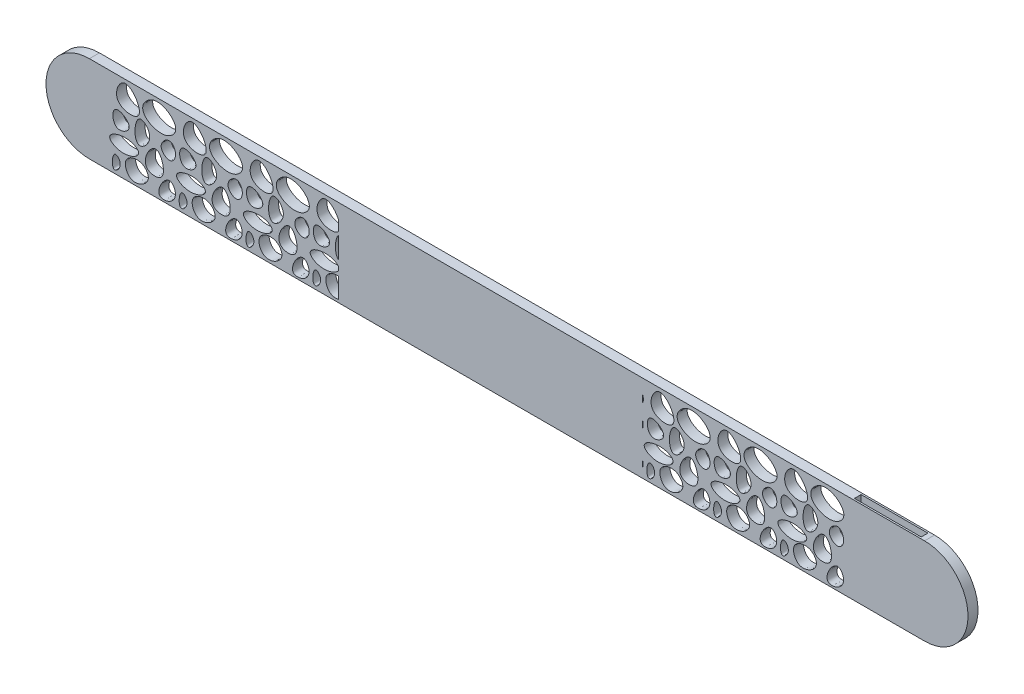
SolidWorks part; units mm, degrees
ref_plane "Alzado" through (0, 0, 0) normal (0, 0, 1) x (1, 0, 0)
ref_plane "Planta" through (0, 0, 0) normal (0, 1, 0) x (1, 0, 0)
ref_plane "Vista lateral" through (0, 0, 0) normal (1, 0, 0) x (0, 0, -1)
sketch "Croquis1" plane through (0, 0, 0) normal (0, 0, 1) x (1, 0, 0)
  line L1 (-120, 13) -> (130, 13)
  line L3 (-120, -13) -> (130, -13)
  arc A0 (130, -13) -> (130, 13) centre (130, 0) ccw
  arc A1 (-120, 13) -> (-120, -13) centre (-120, 0) ccw
  dimension "D1" = 250
  dimension "D2" = 26
  dimension "D3" = 13
  dimension "D4" = 130
extrude "Saliente-Extruir1" add sketch "Croquis1" along normal blind 3
sketch "Croquis7" plane through (0, 13, 0) normal (0, 1, 0) x (1, 0, 0)
  line L0 (130, 0) -> (-120, 0) construction
  line L1 (108.5, -0.5) -> (128.5, -0.5)
  line L2 (108.5, -0.5) -> (108.5, -2.5)
  line L3 (108.5, -2.5) -> (128.5, -2.5)
  line L4 (128.5, -0.5) -> (128.5, -2.5)
  dimension "D1" = 20
  dimension "D2" = 2
  dimension "D3" = 0.5
  dimension "D4" = 1.5
extrude "Cortar-Extruir1" cut sketch "Croquis7" against normal blind 23 and the other way through all
sketch "Croquis9" plane through (0, 0, 0) normal (0, 0, -1) x (-1, 0, 0)
  line L0 (-106.7091, 13) -> (-106.3785, -13) construction
  line L1 (-130, 13) -> (120, 13) construction
  line L2 (120, -13) -> (-130, -13) construction
  line L3 (-25.5, 13) -> (-25.5, -13) construction
  line L4 (25.5, 13) -> (25.5, -13) construction
  spline S0 degree 3 poles (-93.3912, 7.056) (-100.0786, 14.2752) (-108.0642, 8.2517) (-101.9358, 2.7886) (-93.3912, 7.056) (-100.0786, 14.2752) (-108.0642, 8.2517) knots -0.688776 -0.523757 -0.211948 0 0.311224 0.476243 0.788052 1 1.311224 1.476243 1.788052 only from (-99.5922, 11.9229) to (-99.5922, 11.9229)
  spline S1 degree 3 poles (-85.9792, 4.8516) (-90.5397, 15.9234) (-98.4431, 3.5532) (-85.9792, 4.8516) (-90.5397, 15.9234) (-98.4431, 3.5532) knots -1 -0.615056 -0.296776 0 0.384944 0.703224 1 1.384944 1.703224 2 only from (-90.5695, 11.9186) to (-90.5695, 11.9186)
  spline S2 degree 3 poles (-92.8631, -5.3459) (-93.5465, 8.0215) (-99.9978, 1.5338) (-92.8631, -5.3459) (-93.5465, 8.0215) (-99.9978, 1.5338) knots -1 -0.733128 -0.426255 0 0.266872 0.573745 1 1.266872 1.573745 2 only from (-95.1674, 4.9473) to (-95.1674, 4.9473)
  spline S3 degree 3 poles (-94.3645, -7.2568) (-99.4628, 1.9883) (-102.4759, -3.5424) (-102.0366, -8.2256) (-94.3645, -7.2568) (-99.4628, 1.9883) (-102.4759, -3.5424) knots -0.807322 -0.590215 -0.365844 0 0.192678 0.409785 0.634156 1 1.192678 1.409785 1.634156 only from (-99.9609, -0.5054) to (-99.9609, -0.5054)
  spline S4 degree 3 poles (-99.9377, 0.9299) (-104.4145, 5.2302) (-106.4699, 0.7447) (-104.0788, -2.3597) (-99.9377, 0.9299) (-104.4145, 5.2302) (-106.4699, 0.7447) knots -0.732409 -0.553556 -0.284091 0 0.267591 0.446444 0.715909 1 1.267591 1.446444 1.715909 only from (-104.1185, 3.6522) to (-104.1185, 3.6522)
  spline S5 degree 3 poles (-89.4862, -6.8942) (-95.7751, -5.1482) (-99.116, -10.2756) (-92.144, -14.0481) (-89.4862, -6.8942) (-95.7751, -5.1482) (-99.116, -10.2756) knots -0.814733 -0.509077 -0.271879 0 0.185267 0.490923 0.728121 1 1.185267 1.490923 1.728121 only from (-95.8032, -6.4239) to (-95.8032, -6.4239)
  spline S6 degree 3 poles (-98.7079, -12.9336) (-103.3056, -4.6297) (-106.3464, -8.9529) (-104.936, -12.3177) (-98.7079, -12.9336) (-103.3056, -4.6297) (-106.3464, -8.9529) knots -0.848525 -0.604053 -0.402524 0 0.151475 0.395947 0.597476 1 1.151475 1.395947 1.597476 only from (-104.1674, -6.6684) to (-104.1674, -6.6684)
  spline S7 degree 3 poles (-83.5552, -3.8502) (-90.9721, -1.1542) (-96.5501, -4.3001) (-90.2697, -7.6235) (-83.5552, -3.8502) (-90.9721, -1.1542) (-96.5501, -4.3001) knots -0.828964 -0.55664 -0.320938 0 0.171036 0.44336 0.679062 1 1.171036 1.44336 1.679062 only from (-91.894, -2.2362) to (-91.894, -2.2362)
  spline S8 degree 3 poles (-86.3596, -14.089) (-86.8801, -6.0725) (-90.2311, -9.9319) (-86.3596, -14.089) (-86.8801, -6.0725) (-90.2311, -9.9319) knots -1 -0.747213 -0.44036 0 0.252787 0.55964 1 1.252787 1.55964 2 only from (-87.7696, -7.8913) to (-87.7696, -7.8913)
  spline S9 degree 3 poles (-87.0508, -2.7255) (-94.488, 1.1864) (-86.3164, 6.264) (-87.0508, -2.7255) (-94.488, 1.1864) (-86.3164, 6.264) knots -1 -0.637475 -0.302461 0 0.362525 0.697539 1 1.362525 1.697539 2 only from (-91.894, 1.1118) to (-91.894, 1.1118)
  spline S10 degree 3 poles (-73.3912, 7.056) (-80.0786, 14.2752) (-88.0642, 8.2517) (-81.9358, 2.7886) (-73.3912, 7.056) (-80.0786, 14.2752) (-88.0642, 8.2517) knots -0.688776 -0.523757 -0.211948 0 0.311224 0.476243 0.788052 1 1.311224 1.476243 1.788052 only from (-79.5922, 11.9229) to (-79.5922, 11.9229)
  spline S11 degree 3 poles (-65.9792, 4.8516) (-70.5397, 15.9234) (-78.4431, 3.5532) (-65.9792, 4.8516) (-70.5397, 15.9234) (-78.4431, 3.5532) knots -1 -0.615056 -0.296776 0 0.384944 0.703224 1 1.384944 1.703224 2 only from (-70.5695, 11.9186) to (-70.5695, 11.9186)
  spline S12 degree 3 poles (-72.8631, -5.3459) (-73.5465, 8.0215) (-79.9978, 1.5338) (-72.8631, -5.3459) (-73.5465, 8.0215) (-79.9978, 1.5338) knots -1 -0.733128 -0.426255 0 0.266872 0.573745 1 1.266872 1.573745 2 only from (-75.1674, 4.9473) to (-75.1674, 4.9473)
  spline S13 degree 3 poles (-74.3645, -7.2568) (-79.4628, 1.9883) (-82.4759, -3.5424) (-82.0366, -8.2256) (-74.3645, -7.2568) (-79.4628, 1.9883) (-82.4759, -3.5424) knots -0.807322 -0.590215 -0.365844 0 0.192678 0.409785 0.634156 1 1.192678 1.409785 1.634156 only from (-79.9609, -0.5054) to (-79.9609, -0.5054)
  spline S14 degree 3 poles (-79.9377, 0.9299) (-84.4145, 5.2302) (-86.4699, 0.7447) (-84.0788, -2.3597) (-79.9377, 0.9299) (-84.4145, 5.2302) (-86.4699, 0.7447) knots -0.732409 -0.553556 -0.284091 0 0.267591 0.446444 0.715909 1 1.267591 1.446444 1.715909 only from (-84.1185, 3.6522) to (-84.1185, 3.6522)
  spline S15 degree 3 poles (-69.4862, -6.8942) (-75.7751, -5.1482) (-79.116, -10.2756) (-72.144, -14.0481) (-69.4862, -6.8942) (-75.7751, -5.1482) (-79.116, -10.2756) knots -0.814733 -0.509077 -0.271879 0 0.185267 0.490923 0.728121 1 1.185267 1.490923 1.728121 only from (-75.8032, -6.4239) to (-75.8032, -6.4239)
  spline S16 degree 3 poles (-78.7079, -12.9336) (-83.3056, -4.6297) (-86.3464, -8.9529) (-84.936, -12.3177) (-78.7079, -12.9336) (-83.3056, -4.6297) (-86.3464, -8.9529) knots -0.848525 -0.604053 -0.402524 0 0.151475 0.395947 0.597476 1 1.151475 1.395947 1.597476 only from (-84.1674, -6.6684) to (-84.1674, -6.6684)
  spline S17 degree 3 poles (-63.5552, -3.8502) (-70.9721, -1.1542) (-76.5501, -4.3001) (-70.2697, -7.6235) (-63.5552, -3.8502) (-70.9721, -1.1542) (-76.5501, -4.3001) knots -0.828964 -0.55664 -0.320938 0 0.171036 0.44336 0.679062 1 1.171036 1.44336 1.679062 only from (-71.894, -2.2362) to (-71.894, -2.2362)
  spline S18 degree 3 poles (-66.3596, -14.089) (-66.8801, -6.0725) (-70.2311, -9.9319) (-66.3596, -14.089) (-66.8801, -6.0725) (-70.2311, -9.9319) knots -1 -0.747213 -0.44036 0 0.252787 0.55964 1 1.252787 1.55964 2 only from (-67.7696, -7.8913) to (-67.7696, -7.8913)
  spline S19 degree 3 poles (-67.0508, -2.7255) (-74.488, 1.1864) (-66.3164, 6.264) (-67.0508, -2.7255) (-74.488, 1.1864) (-66.3164, 6.264) knots -1 -0.637475 -0.302461 0 0.362525 0.697539 1 1.362525 1.697539 2 only from (-71.894, 1.1118) to (-71.894, 1.1118)
  spline S20 degree 3 poles (-53.3912, 7.056) (-60.0786, 14.2752) (-68.0642, 8.2517) (-61.9358, 2.7886) (-53.3912, 7.056) (-60.0786, 14.2752) (-68.0642, 8.2517) knots -0.688776 -0.523757 -0.211948 0 0.311224 0.476243 0.788052 1 1.311224 1.476243 1.788052 only from (-59.5922, 11.9229) to (-59.5922, 11.9229)
  spline S21 degree 3 poles (-45.9792, 4.8516) (-50.5397, 15.9234) (-58.4431, 3.5532) (-45.9792, 4.8516) (-50.5397, 15.9234) (-58.4431, 3.5532) knots -1 -0.615056 -0.296776 0 0.384944 0.703224 1 1.384944 1.703224 2 only from (-50.5695, 11.9186) to (-50.5695, 11.9186)
  spline S22 degree 3 poles (-52.8631, -5.3459) (-53.5465, 8.0215) (-59.9978, 1.5338) (-52.8631, -5.3459) (-53.5465, 8.0215) (-59.9978, 1.5338) knots -1 -0.733128 -0.426255 0 0.266872 0.573745 1 1.266872 1.573745 2 only from (-55.1674, 4.9473) to (-55.1674, 4.9473)
  spline S23 degree 3 poles (-54.3645, -7.2568) (-59.4628, 1.9883) (-62.4759, -3.5424) (-62.0366, -8.2256) (-54.3645, -7.2568) (-59.4628, 1.9883) (-62.4759, -3.5424) knots -0.807322 -0.590215 -0.365844 0 0.192678 0.409785 0.634156 1 1.192678 1.409785 1.634156 only from (-59.9609, -0.5054) to (-59.9609, -0.5054)
  spline S24 degree 3 poles (-59.9377, 0.9299) (-64.4145, 5.2302) (-66.4699, 0.7447) (-64.0788, -2.3597) (-59.9377, 0.9299) (-64.4145, 5.2302) (-66.4699, 0.7447) knots -0.732409 -0.553556 -0.284091 0 0.267591 0.446444 0.715909 1 1.267591 1.446444 1.715909 only from (-64.1185, 3.6522) to (-64.1185, 3.6522)
  spline S25 degree 3 poles (-49.4862, -6.8942) (-55.7751, -5.1482) (-59.116, -10.2756) (-52.144, -14.0481) (-49.4862, -6.8942) (-55.7751, -5.1482) (-59.116, -10.2756) knots -0.814733 -0.509077 -0.271879 0 0.185267 0.490923 0.728121 1 1.185267 1.490923 1.728121 only from (-55.8032, -6.4239) to (-55.8032, -6.4239)
  spline S26 degree 3 poles (-58.7079, -12.9336) (-63.3056, -4.6297) (-66.3464, -8.9529) (-64.936, -12.3177) (-58.7079, -12.9336) (-63.3056, -4.6297) (-66.3464, -8.9529) knots -0.848525 -0.604053 -0.402524 0 0.151475 0.395947 0.597476 1 1.151475 1.395947 1.597476 only from (-64.1674, -6.6684) to (-64.1674, -6.6684)
  spline S27 degree 3 poles (-43.5552, -3.8502) (-50.9721, -1.1542) (-56.5501, -4.3001) (-50.2697, -7.6235) (-43.5552, -3.8502) (-50.9721, -1.1542) (-56.5501, -4.3001) knots -0.828964 -0.55664 -0.320938 0 0.171036 0.44336 0.679062 1 1.171036 1.44336 1.679062 only from (-51.894, -2.2362) to (-51.894, -2.2362)
  spline S28 degree 3 poles (-46.3596, -14.089) (-46.8801, -6.0725) (-50.2311, -9.9319) (-46.3596, -14.089) (-46.8801, -6.0725) (-50.2311, -9.9319) knots -1 -0.747213 -0.44036 0 0.252787 0.55964 1 1.252787 1.55964 2 only from (-47.7696, -7.8913) to (-47.7696, -7.8913)
  spline S29 degree 3 poles (-47.0508, -2.7255) (-54.488, 1.1864) (-46.3164, 6.264) (-47.0508, -2.7255) (-54.488, 1.1864) (-46.3164, 6.264) knots -1 -0.637475 -0.302461 0 0.362525 0.697539 1 1.362525 1.697539 2 only from (-51.894, 1.1118) to (-51.894, 1.1118)
  spline S30 degree 3 poles (-33.3912, 7.056) (-40.0786, 14.2752) (-48.0642, 8.2517) (-41.9358, 2.7886) (-33.3912, 7.056) (-40.0786, 14.2752) (-48.0642, 8.2517) knots -0.688776 -0.523757 -0.211948 0 0.311224 0.476243 0.788052 1 1.311224 1.476243 1.788052 only from (-39.5922, 11.9229) to (-39.5922, 11.9229)
  spline S31 degree 3 poles (-25.9792, 4.8516) (-30.5397, 15.9234) (-38.4431, 3.5532) (-25.9792, 4.8516) (-30.5397, 15.9234) (-38.4431, 3.5532) knots -1 -0.615056 -0.296776 0 0.384944 0.703224 1 1.384944 1.703224 2 only from (-30.5695, 11.9186) to (-30.5695, 11.9186)
  spline S32 degree 3 poles (-32.8631, -5.3459) (-33.5465, 8.0215) (-39.9978, 1.5338) (-32.8631, -5.3459) (-33.5465, 8.0215) (-39.9978, 1.5338) knots -1 -0.733128 -0.426255 0 0.266872 0.573745 1 1.266872 1.573745 2 only from (-35.1674, 4.9473) to (-35.1674, 4.9473)
  spline S33 degree 3 poles (-34.3645, -7.2568) (-39.4628, 1.9883) (-42.4759, -3.5424) (-42.0366, -8.2256) (-34.3645, -7.2568) (-39.4628, 1.9883) (-42.4759, -3.5424) knots -0.807322 -0.590215 -0.365844 0 0.192678 0.409785 0.634156 1 1.192678 1.409785 1.634156 only from (-39.9609, -0.5054) to (-39.9609, -0.5054)
  spline S34 degree 3 poles (-39.9377, 0.9299) (-44.4145, 5.2302) (-46.4699, 0.7447) (-44.0788, -2.3597) (-39.9377, 0.9299) (-44.4145, 5.2302) (-46.4699, 0.7447) knots -0.732409 -0.553556 -0.284091 0 0.267591 0.446444 0.715909 1 1.267591 1.446444 1.715909 only from (-44.1185, 3.6522) to (-44.1185, 3.6522)
  spline S35 degree 3 poles (-29.4862, -6.8942) (-35.7751, -5.1482) (-39.116, -10.2756) (-32.144, -14.0481) (-29.4862, -6.8942) (-35.7751, -5.1482) (-39.116, -10.2756) knots -0.814733 -0.509077 -0.271879 0 0.185267 0.490923 0.728121 1 1.185267 1.490923 1.728121 only from (-35.8032, -6.4239) to (-35.8032, -6.4239)
  spline S36 degree 3 poles (-38.7079, -12.9336) (-43.3056, -4.6297) (-46.3464, -8.9529) (-44.936, -12.3177) (-38.7079, -12.9336) (-43.3056, -4.6297) (-46.3464, -8.9529) knots -0.848525 -0.604053 -0.402524 0 0.151475 0.395947 0.597476 1 1.151475 1.395947 1.597476 only from (-44.1674, -6.6684) to (-44.1674, -6.6684)
  spline S37 degree 3 poles (-23.5552, -3.8502) (-30.9721, -1.1542) (-36.5501, -4.3001) (-30.2697, -7.6235) (-23.5552, -3.8502) (-30.9721, -1.1542) (-36.5501, -4.3001) knots -0.828964 -0.55664 -0.320938 0 0.171036 0.44336 0.679062 1 1.171036 1.44336 1.679062 only from (-31.894, -2.2362) to (-31.894, -2.2362)
  spline S38 degree 3 poles (-26.7789, -13.9675) (-23.3935, -5.8398) (-30.8462, -9.028) (-26.7789, -13.9675) (-23.3935, -5.8398) (-30.8462, -9.028) knots -1 -0.640159 -0.392048 0 0.359841 0.607952 1 1.359841 1.607952 2 only from (-25.5, -7.8913) to (-25.5, -7.8913)
  spline S39 degree 3 poles (-27.0508, -2.7255) (-34.488, 1.1864) (-26.3164, 6.264) (-27.0508, -2.7255) (-34.488, 1.1864) (-26.3164, 6.264) knots -1 -0.637475 -0.302461 0 0.362525 0.697539 1 1.362525 1.697539 2 only from (-31.894, 1.1118) to (-31.894, 1.1118)
  spline S40 degree 3 poles (-13.3912, 7.056) (-20.0786, 14.2752) (-28.0642, 8.2517) (-21.9358, 2.7886) (-13.3912, 7.056) (-20.0786, 14.2752) (-28.0642, 8.2517) knots -0.688776 -0.523757 -0.211948 0 0.311224 0.476243 0.788052 1 1.311224 1.476243 1.788052 only from (-19.5922, 11.9229) to (-19.5922, 11.9229)
  spline S41 degree 3 poles (-5.9792, 4.8516) (-10.5397, 15.9234) (-18.4431, 3.5532) (-5.9792, 4.8516) (-10.5397, 15.9234) (-18.4431, 3.5532) knots -1 -0.615056 -0.296776 0 0.384944 0.703224 1 1.384944 1.703224 2 only from (-10.5695, 11.9186) to (-10.5695, 11.9186)
  spline S42 degree 3 poles (-12.8631, -5.3459) (-13.5465, 8.0215) (-19.9978, 1.5338) (-12.8631, -5.3459) (-13.5465, 8.0215) (-19.9978, 1.5338) knots -1 -0.733128 -0.426255 0 0.266872 0.573745 1 1.266872 1.573745 2 only from (-15.1674, 4.9473) to (-15.1674, 4.9473)
  spline S43 degree 3 poles (-14.3645, -7.2568) (-19.4628, 1.9883) (-22.4759, -3.5424) (-22.0366, -8.2256) (-14.3645, -7.2568) (-19.4628, 1.9883) (-22.4759, -3.5424) knots -0.807322 -0.590215 -0.365844 0 0.192678 0.409785 0.634156 1 1.192678 1.409785 1.634156 only from (-19.9609, -0.5054) to (-19.9609, -0.5054)
  spline S44 degree 3 poles (-19.9377, 0.9299) (-24.4145, 5.2302) (-26.4699, 0.7447) (-24.0788, -2.3597) (-19.9377, 0.9299) (-24.4145, 5.2302) (-26.4699, 0.7447) knots -0.732409 -0.553556 -0.284091 0 0.267591 0.446444 0.715909 1 1.267591 1.446444 1.715909 only from (-24.1185, 3.6522) to (-24.1185, 3.6522)
  spline S45 degree 3 poles (-9.4862, -6.8942) (-15.7751, -5.1482) (-19.116, -10.2756) (-12.144, -14.0481) (-9.4862, -6.8942) (-15.7751, -5.1482) (-19.116, -10.2756) knots -0.814733 -0.509077 -0.271879 0 0.185267 0.490923 0.728121 1 1.185267 1.490923 1.728121 only from (-15.8032, -6.4239) to (-15.8032, -6.4239)
  spline S46 degree 3 poles (-18.7079, -12.9336) (-23.3056, -4.6297) (-26.3464, -8.9529) (-24.936, -12.3177) (-18.7079, -12.9336) (-23.3056, -4.6297) (-26.3464, -8.9529) knots -0.848525 -0.604053 -0.402524 0 0.151475 0.395947 0.597476 1 1.151475 1.395947 1.597476 only from (-24.1674, -6.6684) to (-24.1674, -6.6684)
  spline S47 degree 3 poles (-3.5552, -3.8502) (-10.9721, -1.1542) (-16.5501, -4.3001) (-10.2697, -7.6235) (-3.5552, -3.8502) (-10.9721, -1.1542) (-16.5501, -4.3001) knots -0.828964 -0.55664 -0.320938 0 0.171036 0.44336 0.679062 1 1.171036 1.44336 1.679062 only from (-11.894, -2.2362) to (-11.894, -2.2362)
  spline S48 degree 3 poles (-6.3596, -14.089) (-6.8801, -6.0725) (-10.2311, -9.9319) (-6.3596, -14.089) (-6.8801, -6.0725) (-10.2311, -9.9319) knots -1 -0.747213 -0.44036 0 0.252787 0.55964 1 1.252787 1.55964 2 only from (-7.7696, -7.8913) to (-7.7696, -7.8913)
  spline S49 degree 3 poles (-7.0508, -2.7255) (-14.488, 1.1864) (-6.3164, 6.264) (-7.0508, -2.7255) (-14.488, 1.1864) (-6.3164, 6.264) knots -1 -0.637475 -0.302461 0 0.362525 0.697539 1 1.362525 1.697539 2 only from (-11.894, 1.1118) to (-11.894, 1.1118)
  spline S50 degree 3 poles (6.6088, 7.056) (-0.0786, 14.2752) (-8.0642, 8.2517) (-1.9358, 2.7886) (6.6088, 7.056) (-0.0786, 14.2752) (-8.0642, 8.2517) knots -0.688776 -0.523757 -0.211948 0 0.311224 0.476243 0.788052 1 1.311224 1.476243 1.788052 only from (0.4078, 11.9229) to (0.4078, 11.9229)
  spline S51 degree 3 poles (14.0208, 4.8516) (9.4603, 15.9234) (1.5569, 3.5532) (14.0208, 4.8516) (9.4603, 15.9234) (1.5569, 3.5532) knots -1 -0.615056 -0.296776 0 0.384944 0.703224 1 1.384944 1.703224 2 only from (9.4305, 11.9186) to (9.4305, 11.9186)
  spline S52 degree 3 poles (7.1369, -5.3459) (6.4535, 8.0215) (0.0022, 1.5338) (7.1369, -5.3459) (6.4535, 8.0215) (0.0022, 1.5338) knots -1 -0.733128 -0.426255 0 0.266872 0.573745 1 1.266872 1.573745 2 only from (4.8326, 4.9473) to (4.8326, 4.9473)
  spline S53 degree 3 poles (5.6355, -7.2568) (0.5372, 1.9883) (-2.4759, -3.5424) (-2.0366, -8.2256) (5.6355, -7.2568) (0.5372, 1.9883) (-2.4759, -3.5424) knots -0.807322 -0.590215 -0.365844 0 0.192678 0.409785 0.634156 1 1.192678 1.409785 1.634156 only from (0.0391, -0.5054) to (0.0391, -0.5054)
  spline S54 degree 3 poles (0.0623, 0.9299) (-4.4145, 5.2302) (-6.4699, 0.7447) (-4.0788, -2.3597) (0.0623, 0.9299) (-4.4145, 5.2302) (-6.4699, 0.7447) knots -0.732409 -0.553556 -0.284091 0 0.267591 0.446444 0.715909 1 1.267591 1.446444 1.715909 only from (-4.1185, 3.6522) to (-4.1185, 3.6522)
  spline S55 degree 3 poles (10.5138, -6.8942) (4.2249, -5.1482) (0.884, -10.2756) (7.856, -14.0481) (10.5138, -6.8942) (4.2249, -5.1482) (0.884, -10.2756) knots -0.814733 -0.509077 -0.271879 0 0.185267 0.490923 0.728121 1 1.185267 1.490923 1.728121 only from (4.1968, -6.4239) to (4.1968, -6.4239)
  spline S56 degree 3 poles (1.2921, -12.9336) (-3.3056, -4.6297) (-6.3464, -8.9529) (-4.936, -12.3177) (1.2921, -12.9336) (-3.3056, -4.6297) (-6.3464, -8.9529) knots -0.848525 -0.604053 -0.402524 0 0.151475 0.395947 0.597476 1 1.151475 1.395947 1.597476 only from (-4.1674, -6.6684) to (-4.1674, -6.6684)
  spline S57 degree 3 poles (16.4448, -3.8502) (9.0279, -1.1542) (3.4499, -4.3001) (9.7303, -7.6235) (16.4448, -3.8502) (9.0279, -1.1542) (3.4499, -4.3001) knots -0.828964 -0.55664 -0.320938 0 0.171036 0.44336 0.679062 1 1.171036 1.44336 1.679062 only from (8.106, -2.2362) to (8.106, -2.2362)
  spline S58 degree 3 poles (13.6404, -14.089) (13.1199, -6.0725) (9.7689, -9.9319) (13.6404, -14.089) (13.1199, -6.0725) (9.7689, -9.9319) knots -1 -0.747213 -0.44036 0 0.252787 0.55964 1 1.252787 1.55964 2 only from (12.2304, -7.8913) to (12.2304, -7.8913)
  spline S59 degree 3 poles (12.9492, -2.7255) (5.512, 1.1864) (13.6836, 6.264) (12.9492, -2.7255) (5.512, 1.1864) (13.6836, 6.264) knots -1 -0.637475 -0.302461 0 0.362525 0.697539 1 1.362525 1.697539 2 only from (8.106, 1.1118) to (8.106, 1.1118)
  spline S60 degree 3 poles (26.6088, 7.056) (19.9214, 14.2752) (11.9358, 8.2517) (18.0642, 2.7886) (26.6088, 7.056) (19.9214, 14.2752) (11.9358, 8.2517) knots -0.688776 -0.523757 -0.211948 0 0.311224 0.476243 0.788052 1 1.311224 1.476243 1.788052 only from (20.4078, 11.9229) to (20.4078, 11.9229)
  spline S61 degree 3 poles (34.0208, 4.8516) (29.4603, 15.9234) (21.5569, 3.5532) (34.0208, 4.8516) (29.4603, 15.9234) (21.5569, 3.5532) knots -1 -0.615056 -0.296776 0 0.384944 0.703224 1 1.384944 1.703224 2 only from (29.4305, 11.9186) to (29.4305, 11.9186)
  spline S62 degree 3 poles (27.1369, -5.3459) (26.4535, 8.0215) (20.0022, 1.5338) (27.1369, -5.3459) (26.4535, 8.0215) (20.0022, 1.5338) knots -1 -0.733128 -0.426255 0 0.266872 0.573745 1 1.266872 1.573745 2 only from (24.8326, 4.9473) to (24.8326, 4.9473)
  spline S63 degree 3 poles (25.6355, -7.2568) (20.5372, 1.9883) (17.5241, -3.5424) (17.9634, -8.2256) (25.6355, -7.2568) (20.5372, 1.9883) (17.5241, -3.5424) knots -0.807322 -0.590215 -0.365844 0 0.192678 0.409785 0.634156 1 1.192678 1.409785 1.634156 only from (20.0391, -0.5054) to (20.0391, -0.5054)
  spline S64 degree 3 poles (20.0623, 0.9299) (15.5855, 5.2302) (13.5301, 0.7447) (15.9212, -2.3597) (20.0623, 0.9299) (15.5855, 5.2302) (13.5301, 0.7447) knots -0.732409 -0.553556 -0.284091 0 0.267591 0.446444 0.715909 1 1.267591 1.446444 1.715909 only from (15.8815, 3.6522) to (15.8815, 3.6522)
  spline S65 degree 3 poles (30.5138, -6.8942) (24.2249, -5.1482) (20.884, -10.2756) (27.856, -14.0481) (30.5138, -6.8942) (24.2249, -5.1482) (20.884, -10.2756) knots -0.814733 -0.509077 -0.271879 0 0.185267 0.490923 0.728121 1 1.185267 1.490923 1.728121 only from (24.1968, -6.4239) to (24.1968, -6.4239)
  spline S66 degree 3 poles (21.2921, -12.9336) (16.6944, -4.6297) (13.6536, -8.9529) (15.064, -12.3177) (21.2921, -12.9336) (16.6944, -4.6297) (13.6536, -8.9529) knots -0.848525 -0.604053 -0.402524 0 0.151475 0.395947 0.597476 1 1.151475 1.395947 1.597476 only from (15.8326, -6.6684) to (15.8326, -6.6684)
  spline S67 degree 3 poles (36.4448, -3.8502) (29.0279, -1.1542) (23.4499, -4.3001) (29.7303, -7.6235) (36.4448, -3.8502) (29.0279, -1.1542) (23.4499, -4.3001) knots -0.828964 -0.55664 -0.320938 0 0.171036 0.44336 0.679062 1 1.171036 1.44336 1.679062 only from (28.106, -2.2362) to (28.106, -2.2362)
  spline S68 degree 3 poles (33.6404, -14.089) (33.1199, -6.0725) (29.7689, -9.9319) (33.6404, -14.089) (33.1199, -6.0725) (29.7689, -9.9319) knots -1 -0.747213 -0.44036 0 0.252787 0.55964 1 1.252787 1.55964 2 only from (32.2304, -7.8913) to (32.2304, -7.8913)
  spline S69 degree 3 poles (32.9492, -2.7255) (25.512, 1.1864) (33.6836, 6.264) (32.9492, -2.7255) (25.512, 1.1864) (33.6836, 6.264) knots -1 -0.637475 -0.302461 0 0.362525 0.697539 1 1.362525 1.697539 2 only from (28.106, 1.1118) to (28.106, 1.1118)
  spline S70 degree 3 poles (46.6088, 7.056) (39.9214, 14.2752) (31.9358, 8.2517) (38.0642, 2.7886) (46.6088, 7.056) (39.9214, 14.2752) (31.9358, 8.2517) knots -0.688776 -0.523757 -0.211948 0 0.311224 0.476243 0.788052 1 1.311224 1.476243 1.788052 only from (40.4078, 11.9229) to (40.4078, 11.9229)
  spline S71 degree 3 poles (54.0208, 4.8516) (49.4603, 15.9234) (41.5569, 3.5532) (54.0208, 4.8516) (49.4603, 15.9234) (41.5569, 3.5532) knots -1 -0.615056 -0.296776 0 0.384944 0.703224 1 1.384944 1.703224 2 only from (49.4305, 11.9186) to (49.4305, 11.9186)
  spline S72 degree 3 poles (47.1369, -5.3459) (46.4535, 8.0215) (40.0022, 1.5338) (47.1369, -5.3459) (46.4535, 8.0215) (40.0022, 1.5338) knots -1 -0.733128 -0.426255 0 0.266872 0.573745 1 1.266872 1.573745 2 only from (44.8326, 4.9473) to (44.8326, 4.9473)
  spline S73 degree 3 poles (45.6355, -7.2568) (40.5372, 1.9883) (37.5241, -3.5424) (37.9634, -8.2256) (45.6355, -7.2568) (40.5372, 1.9883) (37.5241, -3.5424) knots -0.807322 -0.590215 -0.365844 0 0.192678 0.409785 0.634156 1 1.192678 1.409785 1.634156 only from (40.0391, -0.5054) to (40.0391, -0.5054)
  spline S74 degree 3 poles (40.0623, 0.9299) (35.5855, 5.2302) (33.5301, 0.7447) (35.9212, -2.3597) (40.0623, 0.9299) (35.5855, 5.2302) (33.5301, 0.7447) knots -0.732409 -0.553556 -0.284091 0 0.267591 0.446444 0.715909 1 1.267591 1.446444 1.715909 only from (35.8815, 3.6522) to (35.8815, 3.6522)
  spline S75 degree 3 poles (50.5138, -6.8942) (44.2249, -5.1482) (40.884, -10.2756) (47.856, -14.0481) (50.5138, -6.8942) (44.2249, -5.1482) (40.884, -10.2756) knots -0.814733 -0.509077 -0.271879 0 0.185267 0.490923 0.728121 1 1.185267 1.490923 1.728121 only from (44.1968, -6.4239) to (44.1968, -6.4239)
  spline S76 degree 3 poles (41.2921, -12.9336) (36.6944, -4.6297) (33.6536, -8.9529) (35.064, -12.3177) (41.2921, -12.9336) (36.6944, -4.6297) (33.6536, -8.9529) knots -0.848525 -0.604053 -0.402524 0 0.151475 0.395947 0.597476 1 1.151475 1.395947 1.597476 only from (35.8326, -6.6684) to (35.8326, -6.6684)
  spline S77 degree 3 poles (56.4448, -3.8502) (49.0279, -1.1542) (43.4499, -4.3001) (49.7303, -7.6235) (56.4448, -3.8502) (49.0279, -1.1542) (43.4499, -4.3001) knots -0.828964 -0.55664 -0.320938 0 0.171036 0.44336 0.679062 1 1.171036 1.44336 1.679062 only from (48.106, -2.2362) to (48.106, -2.2362)
  spline S78 degree 3 poles (53.6404, -14.089) (53.1199, -6.0725) (49.7689, -9.9319) (53.6404, -14.089) (53.1199, -6.0725) (49.7689, -9.9319) knots -1 -0.747213 -0.44036 0 0.252787 0.55964 1 1.252787 1.55964 2 only from (52.2304, -7.8913) to (52.2304, -7.8913)
  spline S79 degree 3 poles (52.9492, -2.7255) (45.512, 1.1864) (53.6836, 6.264) (52.9492, -2.7255) (45.512, 1.1864) (53.6836, 6.264) knots -1 -0.637475 -0.302461 0 0.362525 0.697539 1 1.362525 1.697539 2 only from (48.106, 1.1118) to (48.106, 1.1118)
  spline S80 degree 3 poles (66.6088, 7.056) (59.9214, 14.2752) (51.9358, 8.2517) (58.0642, 2.7886) (66.6088, 7.056) (59.9214, 14.2752) (51.9358, 8.2517) knots -0.688776 -0.523757 -0.211948 0 0.311224 0.476243 0.788052 1 1.311224 1.476243 1.788052 only from (60.4078, 11.9229) to (60.4078, 11.9229)
  spline S81 degree 3 poles (74.0208, 4.8516) (69.4603, 15.9234) (61.5569, 3.5532) (74.0208, 4.8516) (69.4603, 15.9234) (61.5569, 3.5532) knots -1 -0.615056 -0.296776 0 0.384944 0.703224 1 1.384944 1.703224 2 only from (69.4305, 11.9186) to (69.4305, 11.9186)
  spline S82 degree 3 poles (67.1369, -5.3459) (66.4535, 8.0215) (60.0022, 1.5338) (67.1369, -5.3459) (66.4535, 8.0215) (60.0022, 1.5338) knots -1 -0.733128 -0.426255 0 0.266872 0.573745 1 1.266872 1.573745 2 only from (64.8326, 4.9473) to (64.8326, 4.9473)
  spline S83 degree 3 poles (65.6355, -7.2568) (60.5372, 1.9883) (57.5241, -3.5424) (57.9634, -8.2256) (65.6355, -7.2568) (60.5372, 1.9883) (57.5241, -3.5424) knots -0.807322 -0.590215 -0.365844 0 0.192678 0.409785 0.634156 1 1.192678 1.409785 1.634156 only from (60.0391, -0.5054) to (60.0391, -0.5054)
  spline S84 degree 3 poles (60.0623, 0.9299) (55.5855, 5.2302) (53.5301, 0.7447) (55.9212, -2.3597) (60.0623, 0.9299) (55.5855, 5.2302) (53.5301, 0.7447) knots -0.732409 -0.553556 -0.284091 0 0.267591 0.446444 0.715909 1 1.267591 1.446444 1.715909 only from (55.8815, 3.6522) to (55.8815, 3.6522)
  spline S85 degree 3 poles (70.5138, -6.8942) (64.2249, -5.1482) (60.884, -10.2756) (67.856, -14.0481) (70.5138, -6.8942) (64.2249, -5.1482) (60.884, -10.2756) knots -0.814733 -0.509077 -0.271879 0 0.185267 0.490923 0.728121 1 1.185267 1.490923 1.728121 only from (64.1968, -6.4239) to (64.1968, -6.4239)
  spline S86 degree 3 poles (61.2921, -12.9336) (56.6944, -4.6297) (53.6536, -8.9529) (55.064, -12.3177) (61.2921, -12.9336) (56.6944, -4.6297) (53.6536, -8.9529) knots -0.848525 -0.604053 -0.402524 0 0.151475 0.395947 0.597476 1 1.151475 1.395947 1.597476 only from (55.8326, -6.6684) to (55.8326, -6.6684)
  spline S87 degree 3 poles (76.4448, -3.8502) (69.0279, -1.1542) (63.4499, -4.3001) (69.7303, -7.6235) (76.4448, -3.8502) (69.0279, -1.1542) (63.4499, -4.3001) knots -0.828964 -0.55664 -0.320938 0 0.171036 0.44336 0.679062 1 1.171036 1.44336 1.679062 only from (68.106, -2.2362) to (68.106, -2.2362)
  spline S88 degree 3 poles (73.6404, -14.089) (73.1199, -6.0725) (69.7689, -9.9319) (73.6404, -14.089) (73.1199, -6.0725) (69.7689, -9.9319) knots -1 -0.747213 -0.44036 0 0.252787 0.55964 1 1.252787 1.55964 2 only from (72.2304, -7.8913) to (72.2304, -7.8913)
  spline S89 degree 3 poles (72.9492, -2.7255) (65.512, 1.1864) (73.6836, 6.264) (72.9492, -2.7255) (65.512, 1.1864) (73.6836, 6.264) knots -1 -0.637475 -0.302461 0 0.362525 0.697539 1 1.362525 1.697539 2 only from (68.106, 1.1118) to (68.106, 1.1118)
  spline S90 degree 3 poles (86.6088, 7.056) (79.9214, 14.2752) (71.9358, 8.2517) (78.0642, 2.7886) (86.6088, 7.056) (79.9214, 14.2752) (71.9358, 8.2517) knots -0.688776 -0.523757 -0.211948 0 0.311224 0.476243 0.788052 1 1.311224 1.476243 1.788052 only from (80.4078, 11.9229) to (80.4078, 11.9229)
  spline S91 degree 3 poles (94.0208, 4.8516) (89.4603, 15.9234) (81.5569, 3.5532) (94.0208, 4.8516) (89.4603, 15.9234) (81.5569, 3.5532) knots -1 -0.615056 -0.296776 0 0.384944 0.703224 1 1.384944 1.703224 2 only from (89.4305, 11.9186) to (89.4305, 11.9186)
  spline S92 degree 3 poles (87.1369, -5.3459) (86.4535, 8.0215) (80.0022, 1.5338) (87.1369, -5.3459) (86.4535, 8.0215) (80.0022, 1.5338) knots -1 -0.733128 -0.426255 0 0.266872 0.573745 1 1.266872 1.573745 2 only from (84.8326, 4.9473) to (84.8326, 4.9473)
  spline S93 degree 3 poles (85.6355, -7.2568) (80.5372, 1.9883) (77.5241, -3.5424) (77.9634, -8.2256) (85.6355, -7.2568) (80.5372, 1.9883) (77.5241, -3.5424) knots -0.807322 -0.590215 -0.365844 0 0.192678 0.409785 0.634156 1 1.192678 1.409785 1.634156 only from (80.0391, -0.5054) to (80.0391, -0.5054)
  spline S94 degree 3 poles (80.0623, 0.9299) (75.5855, 5.2302) (73.5301, 0.7447) (75.9212, -2.3597) (80.0623, 0.9299) (75.5855, 5.2302) (73.5301, 0.7447) knots -0.732409 -0.553556 -0.284091 0 0.267591 0.446444 0.715909 1 1.267591 1.446444 1.715909 only from (75.8815, 3.6522) to (75.8815, 3.6522)
  spline S95 degree 3 poles (90.5138, -6.8942) (84.2249, -5.1482) (80.884, -10.2756) (87.856, -14.0481) (90.5138, -6.8942) (84.2249, -5.1482) (80.884, -10.2756) knots -0.814733 -0.509077 -0.271879 0 0.185267 0.490923 0.728121 1 1.185267 1.490923 1.728121 only from (84.1968, -6.4239) to (84.1968, -6.4239)
  spline S96 degree 3 poles (81.2921, -12.9336) (76.6944, -4.6297) (73.6536, -8.9529) (75.064, -12.3177) (81.2921, -12.9336) (76.6944, -4.6297) (73.6536, -8.9529) knots -0.848525 -0.604053 -0.402524 0 0.151475 0.395947 0.597476 1 1.151475 1.395947 1.597476 only from (75.8326, -6.6684) to (75.8326, -6.6684)
  spline S97 degree 3 poles (96.4448, -3.8502) (89.0279, -1.1542) (83.4499, -4.3001) (89.7303, -7.6235) (96.4448, -3.8502) (89.0279, -1.1542) (83.4499, -4.3001) knots -0.828964 -0.55664 -0.320938 0 0.171036 0.44336 0.679062 1 1.171036 1.44336 1.679062 only from (88.106, -2.2362) to (88.106, -2.2362)
  spline S98 degree 3 poles (93.6404, -14.089) (93.1199, -6.0725) (89.7689, -9.9319) (93.6404, -14.089) (93.1199, -6.0725) (89.7689, -9.9319) knots -1 -0.747213 -0.44036 0 0.252787 0.55964 1 1.252787 1.55964 2 only from (92.2304, -7.8913) to (92.2304, -7.8913)
  spline S99 degree 3 poles (92.9492, -2.7255) (85.512, 1.1864) (93.6836, 6.264) (92.9492, -2.7255) (85.512, 1.1864) (93.6836, 6.264) knots -1 -0.637475 -0.302461 0 0.362525 0.697539 1 1.362525 1.697539 2 only from (88.106, 1.1118) to (88.106, 1.1118)
  spline S100 degree 3 poles (106.6088, 7.056) (99.9214, 14.2752) (91.9358, 8.2517) (98.0642, 2.7886) (106.6088, 7.056) (99.9214, 14.2752) (91.9358, 8.2517) knots -0.688776 -0.523757 -0.211948 0 0.311224 0.476243 0.788052 1 1.311224 1.476243 1.788052 only from (100.4078, 11.9229) to (100.4078, 11.9229)
  spline S101 degree 3 poles (114.0208, 4.8516) (109.4603, 15.9234) (101.5569, 3.5532) (114.0208, 4.8516) (109.4603, 15.9234) (101.5569, 3.5532) knots -1 -0.615056 -0.296776 0 0.384944 0.703224 1 1.384944 1.703224 2 only from (109.4305, 11.9186) to (109.4305, 11.9186)
  spline S102 degree 3 poles (107.1369, -5.3459) (106.4535, 8.0215) (100.0022, 1.5338) (107.1369, -5.3459) (106.4535, 8.0215) (100.0022, 1.5338) knots -1 -0.733128 -0.426255 0 0.266872 0.573745 1 1.266872 1.573745 2 only from (104.8326, 4.9473) to (104.8326, 4.9473)
  spline S103 degree 3 poles (105.6355, -7.2568) (100.5372, 1.9883) (97.5241, -3.5424) (97.9634, -8.2256) (105.6355, -7.2568) (100.5372, 1.9883) (97.5241, -3.5424) knots -0.807322 -0.590215 -0.365844 0 0.192678 0.409785 0.634156 1 1.192678 1.409785 1.634156 only from (100.0391, -0.5054) to (100.0391, -0.5054)
  spline S104 degree 3 poles (100.0623, 0.9299) (95.5855, 5.2302) (93.5301, 0.7447) (95.9212, -2.3597) (100.0623, 0.9299) (95.5855, 5.2302) (93.5301, 0.7447) knots -0.732409 -0.553556 -0.284091 0 0.267591 0.446444 0.715909 1 1.267591 1.446444 1.715909 only from (95.8815, 3.6522) to (95.8815, 3.6522)
  spline S105 degree 3 poles (110.5138, -6.8942) (104.2249, -5.1482) (100.884, -10.2756) (107.856, -14.0481) (110.5138, -6.8942) (104.2249, -5.1482) (100.884, -10.2756) knots -0.814733 -0.509077 -0.271879 0 0.185267 0.490923 0.728121 1 1.185267 1.490923 1.728121 only from (104.1968, -6.4239) to (104.1968, -6.4239)
  spline S106 degree 3 poles (101.2921, -12.9336) (96.6944, -4.6297) (93.6536, -8.9529) (95.064, -12.3177) (101.2921, -12.9336) (96.6944, -4.6297) (93.6536, -8.9529) knots -0.848525 -0.604053 -0.402524 0 0.151475 0.395947 0.597476 1 1.151475 1.395947 1.597476 only from (95.8326, -6.6684) to (95.8326, -6.6684)
  spline S107 degree 3 poles (116.4448, -3.8502) (109.0279, -1.1542) (103.4499, -4.3001) (109.7303, -7.6235) (116.4448, -3.8502) (109.0279, -1.1542) (103.4499, -4.3001) knots -0.828964 -0.55664 -0.320938 0 0.171036 0.44336 0.679062 1 1.171036 1.44336 1.679062 only from (108.106, -2.2362) to (108.106, -2.2362)
  spline S108 degree 3 poles (113.6404, -14.089) (113.1199, -6.0725) (109.7689, -9.9319) (113.6404, -14.089) (113.1199, -6.0725) (109.7689, -9.9319) knots -1 -0.747213 -0.44036 0 0.252787 0.55964 1 1.252787 1.55964 2 only from (112.2304, -7.8913) to (112.2304, -7.8913)
  spline S109 degree 3 poles (112.9492, -2.7255) (105.512, 1.1864) (113.6836, 6.264) (112.9492, -2.7255) (105.512, 1.1864) (113.6836, 6.264) knots -1 -0.637475 -0.302461 0 0.362525 0.697539 1 1.362525 1.697539 2 only from (108.106, 1.1118) to (108.106, 1.1118)
  dimension "D1" = 83
  dimension "D2" = 51
extrude "Cortar-Extruir2" cut sketch "Croquis9" against normal through all
sketch "Croquis10" plane through (0, 0, 0) normal (0, 0, -1) x (-1, 0, 0)
  line L0 (-25.5, 13) -> (-25.5, -13) construction
  line L1 (-130, 13) -> (120, 13) construction
  line L2 (120, -13) -> (-130, -13) construction
  line L3 (25.5, 13) -> (25.5, -13) construction
  line L5 (45.5, 13) -> (-45.5, 13)
  line L6 (45.5, 13) -> (45.5, -13)
  line L7 (45.5, -13) -> (-45.5, -13)
  line L8 (-45.5, 13) -> (-45.5, -13)
  dimension "D1" = 51
  dimension "D2" = 83
  dimension "D3" = 20
  dimension "D4" = 20
extrude "Saliente-Extruir2" add sketch "Croquis10" against normal through all
